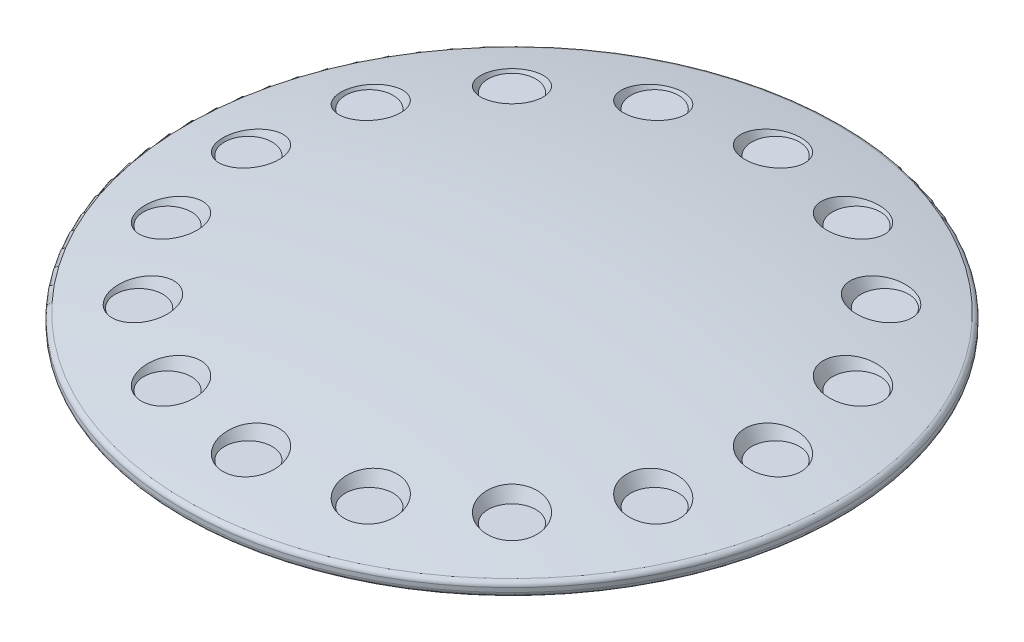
SolidWorks part; units mm, degrees
ref_plane "Plan de face" through (0, 0, 0) normal (0, 0, 1) x (1, 0, 0)
ref_plane "Plan de dessus" through (0, 0, 0) normal (0, 1, 0) x (1, 0, 0)
ref_plane "Plan de droite" through (0, 0, 0) normal (1, 0, 0) x (0, 0, -1)
sketch "Esquisse2" plane through (0, 0, 0) normal (0, 0, 1) x (1, 0, 0)
  line L0 (0, 0) -> (0, 30.5714) construction
  line L1 (64.3485, -2.5869) -> (0, -2.5869)
  line L2 (0, 0) -> (65, 0) construction
  line L3 (0, 6.7378) -> (0, -2.5869)
  line L6 (65, -1.6496) -> (65, -0.8132)
  arc A0 (64.2026, 0.166) -> (0, 6.7378) centre (0, -310.162) ccw
  arc A1 (65, -0.8132) -> (64.2026, 0.166) centre (64, -0.8132) ccw
  arc A2 (64.3485, -2.5869) -> (65, -1.6496) centre (64, -1.6496) ccw
  point P18 (65, -2.3447)
  dimension "D3" = 1
  dimension "D1" = 65
revolve "Révolution1" add sketch "Esquisse2" angle 360 about L0
ref_plane "Plan1" through (0, 5, 0) normal (0, 1, 0) x (-1, 0, 0)
sketch "Esquisse3" plane through (0, 5, 0) normal (0, 1, 0) x (1, 0, 0)
  line L0 (0, 0) -> (0, 3.12) construction
  line L1 (0, 70.6044) -> (0, 0) construction
  circle A0 centre (0, 52) radius 7
  circle A1 centre (19.8995, 48.0417) radius 7
  circle A2 centre (36.7696, 36.7696) radius 7
  circle A3 centre (48.0417, 19.8995) radius 7
  circle A4 centre (52, 0) radius 7
  circle A5 centre (48.0417, -19.8995) radius 7
  circle A6 centre (36.7696, -36.7696) radius 7
  circle A7 centre (19.8995, -48.0417) radius 7
  circle A8 centre (0, -52) radius 7
  circle A9 centre (-19.8995, -48.0417) radius 7
  circle A10 centre (-36.7696, -36.7696) radius 7
  circle A11 centre (-48.0417, -19.8995) radius 7
  circle A12 centre (-52, 0) radius 7
  circle A13 centre (-48.0417, 19.8995) radius 7
  circle A14 centre (-36.7696, 36.7696) radius 7
  circle A15 centre (-19.8995, 48.0417) radius 7
  dimension "D1" = 52
  dimension "D2" = 14
extrude "Enlèv. mat.-Extru.1" cut sketch "Esquisse3" against normal blind 4 draft 30
sketch "Esquisse4" plane through (0, -2.5869, 0) normal (0, -1, 0) x (1, 0, 0)
  circle A0 centre (0, 0) radius 62 construction
  circle A1 centre (62, 0) radius 1.25
  dimension "D1" = 124
extrude "Enlèv. mat.-Extru.2" cut sketch "Esquisse4" against normal blind 1
